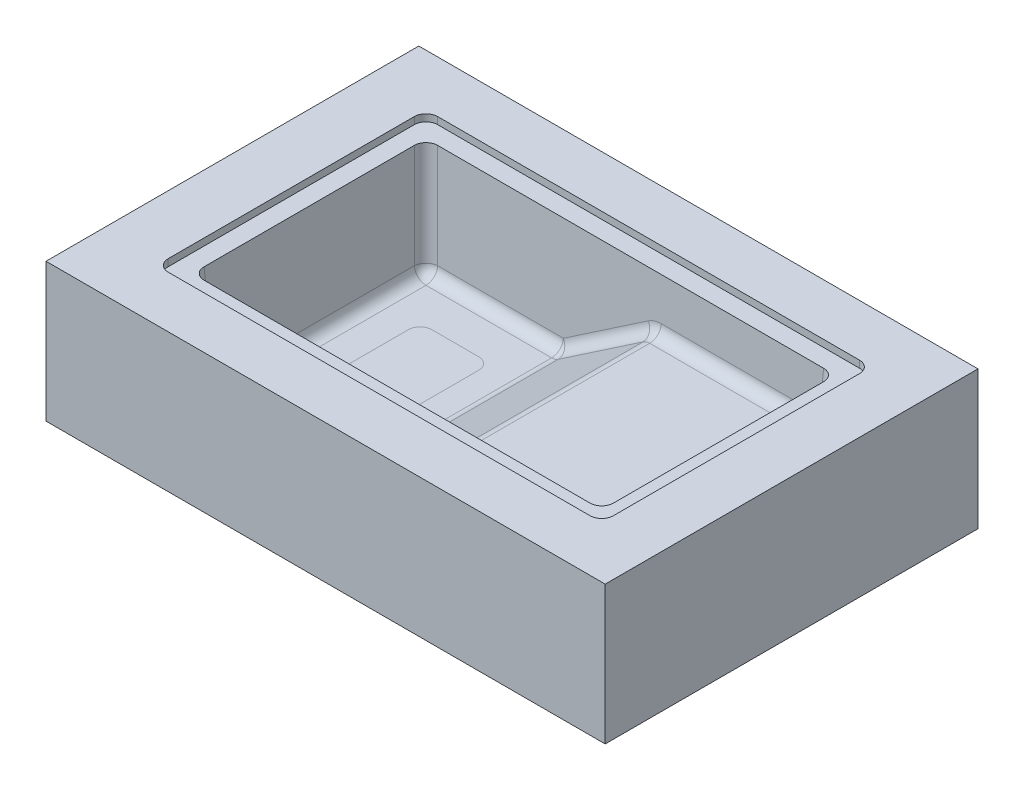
SolidWorks part; units mm, degrees
ref_plane "Front Plane" through (0, 0, 0) normal (0, 0, 1) x (1, 0, 0)
ref_plane "Top Plane" through (0, 0, 0) normal (0, 1, 0) x (1, 0, 0)
ref_plane "Right Plane" through (0, 0, 0) normal (1, 0, 0) x (0, 0, -1)
surface "Surface-Radiate1" parameters "D1"=10
surface "Surface-Knit2"
ref_plane "Plane1" through (0, -75.8126, 0) normal (0, -1, 0) x (-1, 0, 0)
sketch "Sketch2" plane through (0, -75.8126, 0) normal (0, -1, 0) x (-1, 0, 0)
  line L4 (196.2569, 136.5) -> (-199.7431, 136.5)
  line L5 (-220.7431, 115.5) -> (-220.7431, -115.5)
  line L6 (-199.7431, -136.5) -> (196.2569, -136.5)
  line L7 (217.2569, -115.5) -> (217.2569, 115.5)
  line L8 (196.2569, 136.5) -> (-199.7431, 136.5)
  line L9 (-220.7431, 115.5) -> (-220.7431, -115.5)
  line L10 (-199.7431, -136.5) -> (196.2569, -136.5)
  line L11 (217.2569, -115.5) -> (217.2569, 115.5)
  arc A4 (217.2569, 115.5) -> (196.2569, 136.5) centre (196.2569, 115.5) ccw
  arc A5 (-199.7431, 136.5) -> (-220.7431, 115.5) centre (-199.7431, 115.5) ccw
  arc A6 (-220.7431, -115.5) -> (-199.7431, -136.5) centre (-199.7431, -115.5) ccw
  arc A7 (196.2569, -136.5) -> (217.2569, -115.5) centre (196.2569, -115.5) ccw
  arc A8 (217.2569, 115.5) -> (196.2569, 136.5) centre (196.2569, 115.5) ccw
  arc A9 (-199.7431, 136.5) -> (-220.7431, 115.5) centre (-199.7431, 115.5) ccw
  arc A10 (-220.7431, -115.5) -> (-199.7431, -136.5) centre (-199.7431, -115.5) ccw
  arc A11 (196.2569, -136.5) -> (217.2569, -115.5) centre (196.2569, -115.5) ccw
  dimension "D1" = 0
extrude "Boss-Extrude1" add sketch "Sketch2" against normal up to surface (130 mm away)
sketch "Sketch3" plane through (0, -75.8126, 0) normal (0, -1, 0) x (1, 0, 0)
  line L1 (-262.5, -175) -> (262.5, -175)
  line L2 (-262.5, -175) -> (-262.5, 175)
  line L3 (-262.5, 175) -> (262.5, 175)
  line L4 (262.5, -175) -> (262.5, 175)
  line L5 (-262.5, -175) -> (262.5, 175) construction
  line L6 (-262.5, 175) -> (262.5, -175) construction
  point P0 (0, 0)
  dimension "D1" = 525
  dimension "D2" = 350
extrude "Boss-Extrude2" add sketch "Sketch3" against normal blind 130 contours L1 L4 L3 L2 M3 M10 M9 M8 M7 M6 M5 M4
